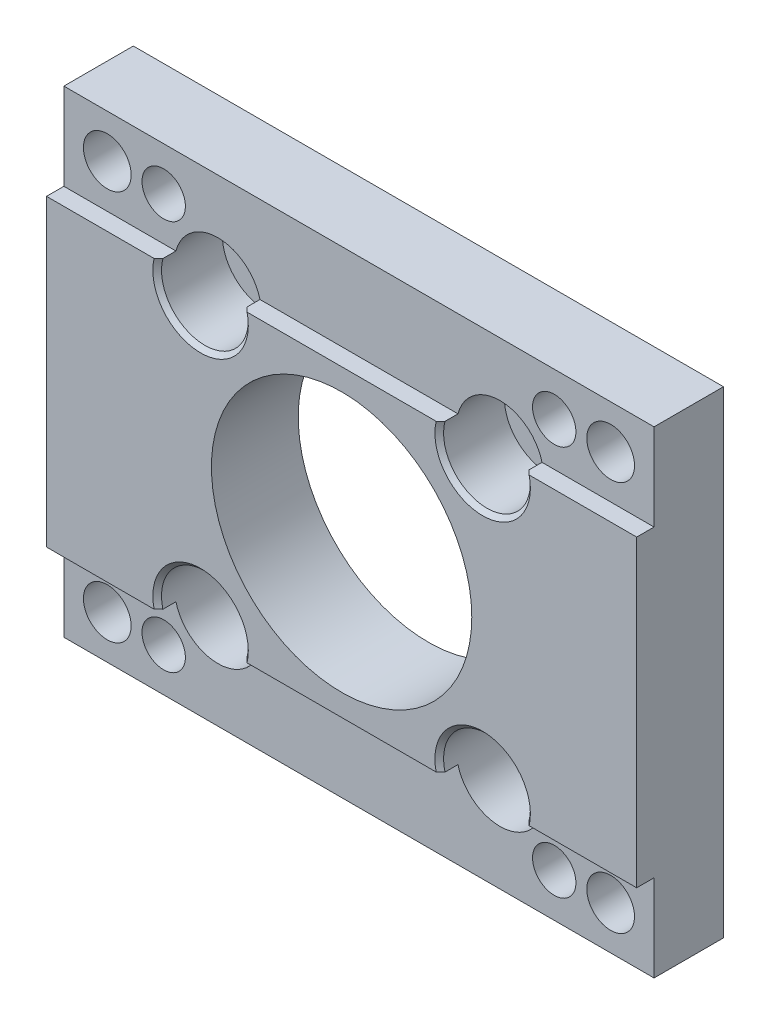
SolidWorks part; units mm, degrees
ref_plane "Plan de face" through (0, 0, 0) normal (0, 0, 1) x (1, 0, 0)
ref_plane "Plan de dessus" through (0, 0, 0) normal (0, 1, 0) x (1, 0, 0)
ref_plane "Plan de droite" through (0, 0, 0) normal (1, 0, 0) x (0, 0, -1)
sketch "Esquisse1" plane through (0, 0, 0) normal (0, 0, 1) x (1, 0, 0)
  line L1 (-34, 27.5) -> (34, 27.5)
  line L2 (-34, 27.5) -> (-34, -27.5)
  line L3 (-34, -27.5) -> (34, -27.5)
  line L4 (34, 27.5) -> (34, -27.5)
  circle A0 centre (0, 0) radius 15
  point P6 (0, -27.5)
  point P7 (34, 0)
  dimension "D3" = 30
  dimension "D1" = 55
  dimension "D2" = 68
extrude "Extrusion1" add sketch "Esquisse1" along normal blind 10
hole_wizard "Chambrage pour vis à tête hexagonale M51" positions "Esquisse3" profile "Esquisse2" counterbore size "M5" standard "ISO"
sketch "Esquisse3" plane through (0, 0, 10) normal (0, 0, 1) x (1, 0, 0)
  point P0 (-16.25, 16.25)
  dimension "D1" = 16.25
  dimension "D2" = 16.25
sketch "Esquisse2" plane through (-16.25, 16.25, 10) normal (1, 0, 0) x (0, -1, 0)
  line L0 (0, 0) -> (0, 10)
  line L1 (0, 10) -> (2.75, 10)
  line L3 (2.75, 10) -> (2.75, 7.5)
  line L4 (5, 7.5) -> (2.75, 7.5)
  line L5 (5, 7.5) -> (5, 0.5)
  line L6 (5, 0.5) -> (5.5, 0)
  line L7 (5.5, 0) -> (0, 0)
  line L8 (-5, 0.5) -> (-5.5, 0) construction
  line L11 (0, -6.35) -> (0, 107.95) construction
  dimension "Diamètre du perçage jusqu'au prochain" = 5.5
  dimension "Profondeur du perçage jusqu'au prochain" = 10
  dimension "Diamètre du chambrage" = 10
  dimension "Profondeur du chambrage" = 7.5
  dimension "Diamètre du fraisage entrant" = 11
  dimension "Angle du fraisage entrant" = 90
pattern_linear "Répétition linéaire1" count 2 spacing 32.5 along (1, 0, 0) count 2 spacing 32.5 along (0, -1, 0) of "Chambrage pour vis à tête hexagonale M51"
hole_wizard "Dégagement M51" positions "Esquisse3D2" profile "Esquisse10" hole size "M5" standard "ISO"
sketch3d "Esquisse3D2"
  point P0 (-29, -22.5, 0)
  dimension "D1" = 22.5
  dimension "D2" = 29
sketch "Esquisse10" plane through (-29, -22.5, 0) normal (1, 0, 0) x (0, 1, 0)
  line L0 (0, 0) -> (0, 10)
  line L1 (0, 10) -> (2.75, 10)
  line L2 (2.75, 10) -> (2.75, 0.25)
  line L3 (2.75, 0.25) -> (3, 0)
  line L5 (3, 0) -> (0, 0)
  line L6 (-2.75, 0.25) -> (-3, 0) construction
  line L11 (0, -6.35) -> (0, 107.95) construction
  dimension "Diamètre du perçage jusqu'au prochain" = 5.5
  dimension "Profondeur du perçage jusqu'au prochain" = 10
  dimension "Diamètre du fraisage entrant" = 6
  dimension "Angle du fraisage entrant" = 90
pattern_linear "Répétition linéaire2" count 2 spacing 58 along (1, 0, 0) count 2 spacing 45 along (0, 1, 0) of "Dégagement M51"
hole_wizard "Diamètre du perçage M5.0 (5.000000)1" positions "Esquisse3D3" profile "Esquisse11" hole size "M5.0" standard "ISO"
sketch3d "Esquisse3D3"
  point P0 (-22.5, -22.5, 0)
  dimension "D1" = 22.5
  dimension "D2" = 22.5
sketch "Esquisse11" plane through (-22.5, -22.5, 0) normal (1, 0, 0) x (0, 1, 0)
  line L0 (0, 0) -> (0, 10)
  line L1 (0, 10) -> (2.5, 10)
  line L2 (2.5, 10) -> (2.5, 0.5)
  line L3 (2.5, 0.5) -> (3, 0)
  line L5 (3, 0) -> (0, 0)
  line L6 (-2.5, 0.5) -> (-3, 0) construction
  line L11 (0, -6.35) -> (0, 107.95) construction
  dimension "Diamètre du perçage jusqu'au prochain" = 5
  dimension "Profondeur du perçage jusqu'au prochain" = 10
  dimension "Diamètre du fraisage entrant" = 6
  dimension "Angle du fraisage entrant" = 90
pattern_linear "Répétition linéaire3" count 2 spacing 45 along (1, 0, 0) count 2 spacing 45 along (0, 1, 0) of "Diamètre du perçage M5.0 (5.000000)1"
sketch "Esquisse13" plane through (-34, 0, 0) normal (-1, 0, 0) x (0, 0, 1)
  line L1 (10, 27.5) -> (8, 27.5)
  line L2 (10, 27.5) -> (10, 17.5)
  line L3 (10, 17.5) -> (8, 17.5)
  line L4 (8, 27.5) -> (8, 17.5)
  dimension "D1" = 10
  dimension "D2" = 2
extrude "Enlèv. mat.-Extru.1" cut sketch "Esquisse13" against normal through all
mirror "Symétrie1" about plane through (0, 0, 0) normal (0, 1, 0) of "Enlèv. mat.-Extru.1"
sketch "Esquisse14" plane through (0, 0, 0) normal (0, 0, -1) x (-1, 0, 0)
  line L0 (0, 0) -> (34, 0)
  line L1 (34, 27.5) -> (34, -27.5) construction
  line L2 (0, 0) -> (0, 27.5)
  line L3 (-34, 27.5) -> (34, 27.5) construction
extrude "Coupe au quart" cut sketch "Esquisse14" against normal through all and the other way through all flip side to cut
